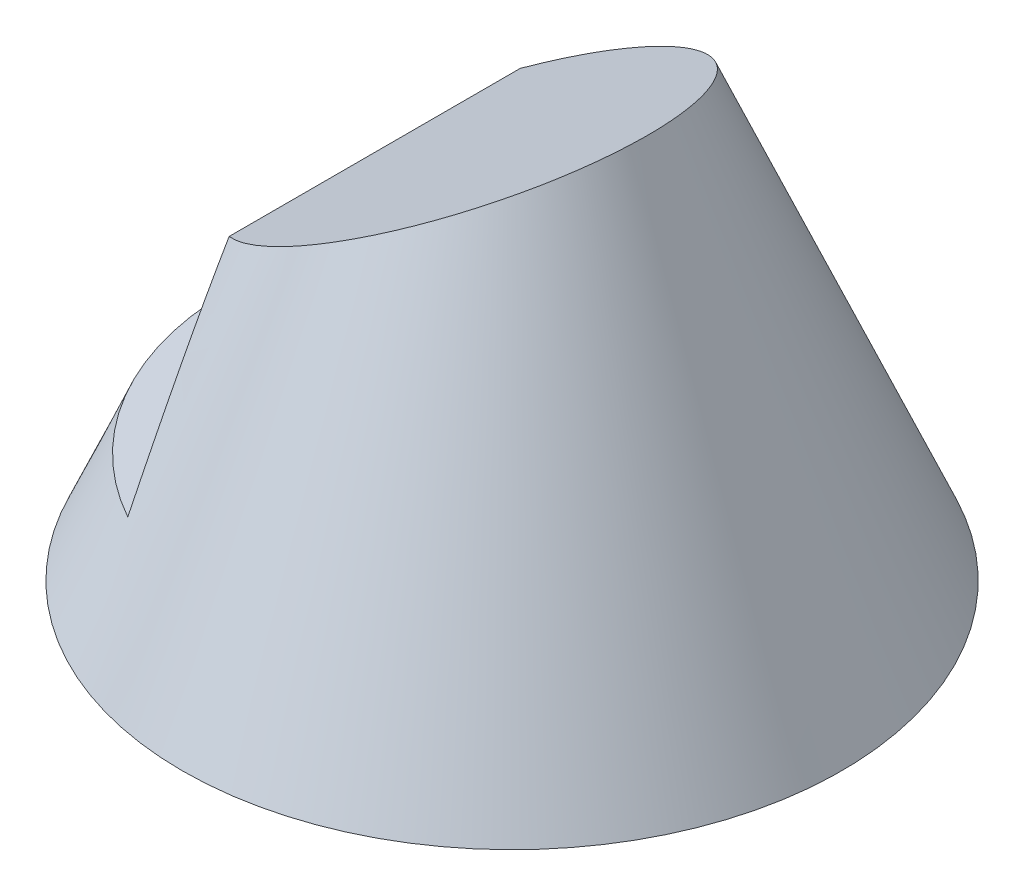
SolidWorks part; units mm, degrees
ref_plane "前视" through (0, 0, 0) normal (0, 0, 1) x (1, 0, 0)
ref_plane "上视" through (0, 0, 0) normal (0, 1, 0) x (1, 0, 0)
ref_plane "右视" through (0, 0, 0) normal (1, 0, 0) x (0, 0, -1)
sketch "草图1" plane through (0, 0, 0) normal (0, 0, 1) x (1, 0, 0)
  line L0 (0, 0) -> (-24, 0)
  line L1 (-24, 0) -> (0, 56)
  line L2 (0, 56) -> (0, 0)
  line L3 (0, 0) -> (0, -31.1561) construction
  dimension "D1" = 48
  dimension "D2" = 56
revolve "旋转1" add sketch "草图1" angle 360 about L3
sketch "草图2" plane through (0, 0, 0) normal (0, 0, 1) x (1, 0, 0)
  line L0 (-34.2202, 8) -> (-10, 8)
  line L1 (-10, 8) -> (-10, 22)
  line L2 (-10, 22) -> (17.648, 37.3158)
  line L3 (-24, 0) -> (24, 0) construction
  line L4 (24, 0) -> (0, 56) construction
  point P7 (9.8571, 33)
  dimension "D1" = 8
  dimension "D2" = 10
  dimension "D3" = 22
  dimension "D4" = 33
extrude "切除-拉伸1" cut sketch "草图2" against normal through all and the other way through all
